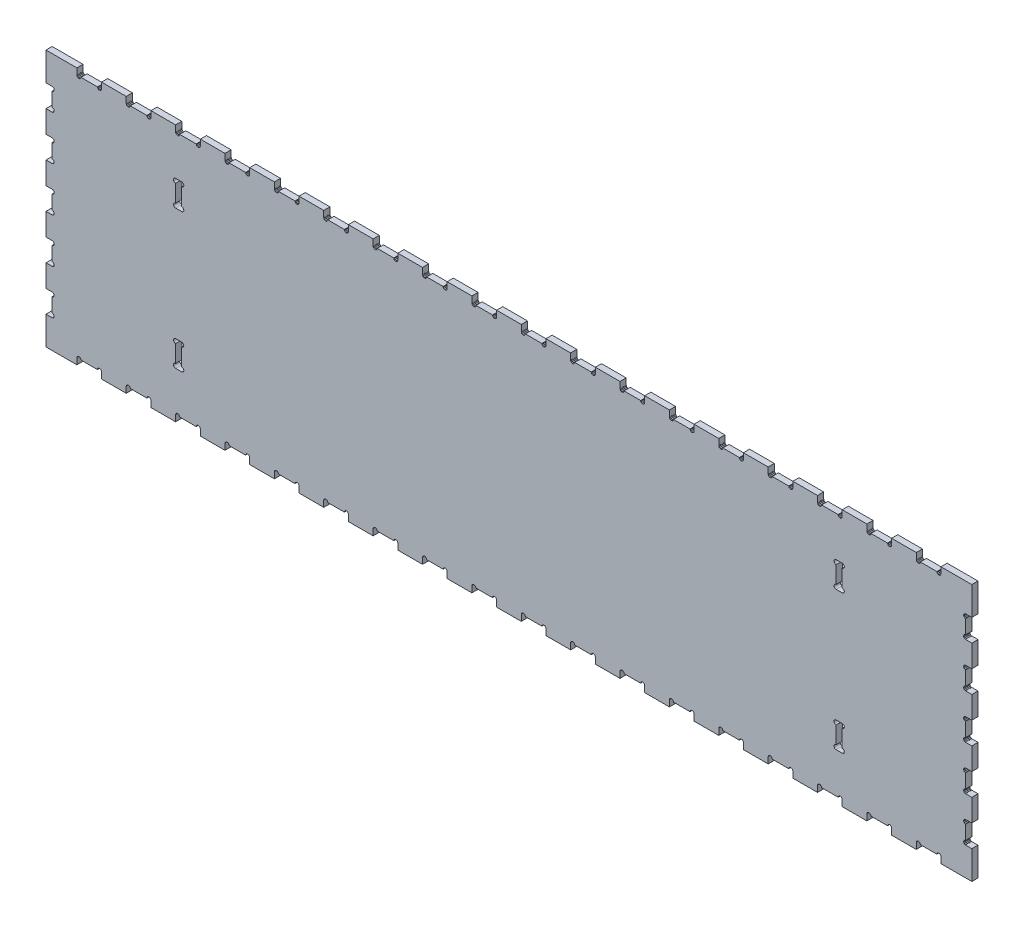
SolidWorks part; units mm, degrees
ref_plane "Спереди" through (0, 0, 0) normal (0, 0, 1) x (1, 0, 0)
ref_plane "Сверху" through (0, 0, 0) normal (0, 1, 0) x (1, 0, 0)
ref_plane "Справа" through (0, 0, 0) normal (1, 0, 0) x (0, 0, -1)
sketch "Sketch1" plane through (0, 0, 0) normal (0, 0, 1) x (1, 0, 0)
  line L0 (1136, -500) -> (1136.09, -500)
  line L1 (1136.09, -500) -> (1136.03, -499.518)
  line L2 (1136.03, -499.518) -> (1136.71, -497.728)
  line L3 (1136.71, -497.728) -> (1138.14, -496.458)
  line L4 (1138.14, -496.458) -> (1140, -496)
  line L5 (1140, -496) -> (1141.86, -496.458)
  line L6 (1141.86, -496.458) -> (1143.29, -497.728)
  line L7 (1143.29, -497.728) -> (1143.97, -499.518)
  line L8 (1143.97, -499.518) -> (1143.91, -500)
  line L9 (1143.91, -500) -> (1176.09, -500)
  line L10 (1176.09, -500) -> (1176.03, -499.518)
  line L11 (1176.03, -499.518) -> (1176.71, -497.728)
  line L12 (1176.71, -497.728) -> (1178.14, -496.458)
  line L13 (1178.14, -496.458) -> (1180, -496)
  line L14 (1180, -496) -> (1181.86, -496.458)
  line L15 (1181.86, -496.458) -> (1183.29, -497.728)
  line L16 (1183.29, -497.728) -> (1183.97, -499.518)
  line L17 (1183.97, -499.518) -> (1183.91, -500)
  line L18 (1183.91, -500) -> (1184, -500)
  line L19 (1184, -500) -> (1184, -512)
  line L20 (1184, -512) -> (1232, -512)
  line L21 (1232, -512) -> (1232, -500)
  line L22 (1232, -500) -> (1232.09, -500)
  line L23 (1232.09, -500) -> (1232.03, -499.518)
  line L24 (1232.03, -499.518) -> (1232.71, -497.728)
  line L25 (1232.71, -497.728) -> (1234.14, -496.458)
  line L26 (1234.14, -496.458) -> (1236, -496)
  line L27 (1236, -496) -> (1237.86, -496.458)
  line L28 (1237.86, -496.458) -> (1239.29, -497.728)
  line L29 (1239.29, -497.728) -> (1239.97, -499.518)
  line L30 (1239.97, -499.518) -> (1239.91, -500)
  line L31 (1239.91, -500) -> (1272.09, -500)
  line L32 (1272.09, -500) -> (1272.03, -499.518)
  line L33 (1272.03, -499.518) -> (1272.71, -497.728)
  line L34 (1272.71, -497.728) -> (1274.14, -496.458)
  line L35 (1274.14, -496.458) -> (1276, -496)
  line L36 (1276, -496) -> (1277.86, -496.458)
  line L37 (1277.86, -496.458) -> (1279.29, -497.728)
  line L38 (1279.29, -497.728) -> (1279.97, -499.518)
  line L39 (1279.97, -499.518) -> (1279.91, -500)
  line L40 (1279.91, -500) -> (1280, -500)
  line L41 (1280, -500) -> (1280, -512)
  line L42 (1280, -512) -> (1328, -512)
  line L43 (1328, -512) -> (1328, -500)
  line L44 (1328, -500) -> (1328.09, -500)
  line L45 (1328.09, -500) -> (1328.03, -499.518)
  line L46 (1328.03, -499.518) -> (1328.71, -497.728)
  line L47 (1328.71, -497.728) -> (1330.14, -496.458)
  line L48 (1330.14, -496.458) -> (1332, -496)
  line L49 (1332, -496) -> (1333.86, -496.458)
  line L50 (1333.86, -496.458) -> (1335.29, -497.728)
  line L51 (1335.29, -497.728) -> (1335.97, -499.518)
  line L52 (1335.97, -499.518) -> (1335.91, -500)
  line L53 (1335.91, -500) -> (1368.09, -500)
  line L54 (1368.09, -500) -> (1368.03, -499.518)
  line L55 (1368.03, -499.518) -> (1368.71, -497.728)
  line L56 (1368.71, -497.728) -> (1370.14, -496.458)
  line L57 (1370.14, -496.458) -> (1372, -496)
  line L58 (1372, -496) -> (1373.86, -496.458)
  line L59 (1373.86, -496.458) -> (1375.29, -497.728)
  line L60 (1375.29, -497.728) -> (1375.97, -499.518)
  line L61 (1375.97, -499.518) -> (1375.91, -500)
  line L62 (1375.91, -500) -> (1376, -500)
  line L63 (1376, -500) -> (1376, -512)
  line L64 (1376, -512) -> (1424, -512)
  line L65 (1424, -512) -> (1424, -500)
  line L66 (1424, -500) -> (1424.09, -500)
  line L67 (1424.09, -500) -> (1424.03, -499.518)
  line L68 (1424.03, -499.518) -> (1424.71, -497.728)
  line L69 (1424.71, -497.728) -> (1426.14, -496.458)
  line L70 (1426.14, -496.458) -> (1428, -496)
  line L71 (1428, -496) -> (1429.86, -496.458)
  line L72 (1429.86, -496.458) -> (1431.29, -497.728)
  line L73 (1431.29, -497.728) -> (1431.97, -499.518)
  line L74 (1431.97, -499.518) -> (1431.91, -500)
  line L75 (1431.91, -500) -> (1464.09, -500)
  line L76 (1464.09, -500) -> (1464.03, -499.518)
  line L77 (1464.03, -499.518) -> (1464.71, -497.728)
  line L78 (1464.71, -497.728) -> (1466.14, -496.458)
  line L79 (1466.14, -496.458) -> (1468, -496)
  line L80 (1468, -496) -> (1469.86, -496.458)
  line L81 (1469.86, -496.458) -> (1471.29, -497.728)
  line L82 (1471.29, -497.728) -> (1471.97, -499.518)
  line L83 (1471.97, -499.518) -> (1471.91, -500)
  line L84 (1471.91, -500) -> (1472, -500)
  line L85 (1472, -500) -> (1472, -512)
  line L86 (1472, -512) -> (1520, -512)
  line L87 (1520, -512) -> (1520, -500)
  line L88 (1520, -500) -> (1520.09, -500)
  line L89 (1520.09, -500) -> (1520.03, -499.518)
  line L90 (1520.03, -499.518) -> (1520.71, -497.728)
  line L91 (1520.71, -497.728) -> (1522.14, -496.458)
  line L92 (1522.14, -496.458) -> (1524, -496)
  line L93 (1524, -496) -> (1525.86, -496.458)
  line L94 (1525.86, -496.458) -> (1527.29, -497.728)
  line L95 (1527.29, -497.728) -> (1527.97, -499.518)
  line L96 (1527.97, -499.518) -> (1527.91, -500)
  line L97 (1527.91, -500) -> (1560.09, -500)
  line L98 (1560.09, -500) -> (1560.03, -499.518)
  line L99 (1560.03, -499.518) -> (1560.71, -497.728)
  line L100 (1560.71, -497.728) -> (1562.14, -496.458)
  line L101 (1562.14, -496.458) -> (1564, -496)
  line L102 (1564, -496) -> (1565.86, -496.458)
  line L103 (1565.86, -496.458) -> (1567.29, -497.728)
  line L104 (1567.29, -497.728) -> (1567.97, -499.518)
  line L105 (1567.97, -499.518) -> (1567.91, -500)
  line L106 (1567.91, -500) -> (1568, -500)
  line L107 (1568, -500) -> (1568, -512)
  line L108 (1568, -512) -> (1616, -512)
  line L109 (1616, -512) -> (1616, -500)
  line L110 (1616, -500) -> (1616.09, -500)
  line L111 (1616.09, -500) -> (1616.03, -499.518)
  line L112 (1616.03, -499.518) -> (1616.71, -497.728)
  line L113 (1616.71, -497.728) -> (1618.14, -496.458)
  line L114 (1618.14, -496.458) -> (1620, -496)
  line L115 (1620, -496) -> (1621.86, -496.458)
  line L116 (1621.86, -496.458) -> (1623.29, -497.728)
  line L117 (1623.29, -497.728) -> (1623.97, -499.518)
  line L118 (1623.97, -499.518) -> (1623.91, -500)
  line L119 (1623.91, -500) -> (1656.09, -500)
  line L120 (1656.09, -500) -> (1656.03, -499.518)
  line L121 (1656.03, -499.518) -> (1656.71, -497.728)
  line L122 (1656.71, -497.728) -> (1658.14, -496.458)
  line L123 (1658.14, -496.458) -> (1660, -496)
  line L124 (1660, -496) -> (1661.86, -496.458)
  line L125 (1661.86, -496.458) -> (1663.29, -497.728)
  line L126 (1663.29, -497.728) -> (1663.97, -499.518)
  line L127 (1663.97, -499.518) -> (1663.91, -500)
  line L128 (1663.91, -500) -> (1664, -500)
  line L129 (1664, -500) -> (1664, -512)
  line L130 (1664, -512) -> (1712, -512)
  line L131 (1712, -512) -> (1712, -500)
  line L132 (1712, -500) -> (1712.09, -500)
  line L133 (1712.09, -500) -> (1712.03, -499.518)
  line L134 (1712.03, -499.518) -> (1712.71, -497.728)
  line L135 (1712.71, -497.728) -> (1714.14, -496.458)
  line L136 (1714.14, -496.458) -> (1716, -496)
  line L137 (1716, -496) -> (1717.86, -496.458)
  line L138 (1717.86, -496.458) -> (1719.29, -497.728)
  line L139 (1719.29, -497.728) -> (1719.97, -499.518)
  line L140 (1719.97, -499.518) -> (1719.91, -500)
  line L141 (1719.91, -500) -> (1752.09, -500)
  line L142 (1752.09, -500) -> (1752.03, -499.518)
  line L143 (1752.03, -499.518) -> (1752.71, -497.728)
  line L144 (1752.71, -497.728) -> (1754.14, -496.458)
  line L145 (1754.14, -496.458) -> (1756, -496)
  line L146 (1756, -496) -> (1757.86, -496.458)
  line L147 (1757.86, -496.458) -> (1759.29, -497.728)
  line L148 (1759.29, -497.728) -> (1759.97, -499.518)
  line L149 (1759.97, -499.518) -> (1759.91, -500)
  line L150 (1759.91, -500) -> (1760, -500)
  line L151 (1760, -500) -> (1760, -512)
  line L152 (1760, -512) -> (1808, -512)
  line L153 (1808, -512) -> (1808, -500)
  line L154 (1808, -500) -> (1808.09, -500)
  line L155 (1808.09, -500) -> (1808.03, -499.518)
  line L156 (1808.03, -499.518) -> (1808.71, -497.728)
  line L157 (1808.71, -497.728) -> (1810.14, -496.458)
  line L158 (1810.14, -496.458) -> (1812, -496)
  line L159 (1812, -496) -> (1813.86, -496.458)
  line L160 (1813.86, -496.458) -> (1815.29, -497.728)
  line L161 (1815.29, -497.728) -> (1815.97, -499.518)
  line L162 (1815.97, -499.518) -> (1815.91, -500)
  line L163 (1815.91, -500) -> (1848.09, -500)
  line L164 (1848.09, -500) -> (1848.03, -499.518)
  line L165 (1848.03, -499.518) -> (1848.71, -497.728)
  line L166 (1848.71, -497.728) -> (1850.14, -496.458)
  line L167 (1850.14, -496.458) -> (1852, -496)
  line L168 (1852, -496) -> (1853.86, -496.458)
  line L169 (1853.86, -496.458) -> (1855.29, -497.728)
  line L170 (1855.29, -497.728) -> (1855.97, -499.518)
  line L171 (1855.97, -499.518) -> (1855.91, -500)
  line L172 (1855.91, -500) -> (1856, -500)
  line L173 (1856, -500) -> (1856, -512)
  line L174 (1856, -512) -> (1904, -512)
  line L175 (1904, -512) -> (1904, -500)
  line L176 (1904, -500) -> (1904.09, -500)
  line L177 (1904.09, -500) -> (1904.03, -499.518)
  line L178 (1904.03, -499.518) -> (1904.71, -497.728)
  line L179 (1904.71, -497.728) -> (1906.14, -496.458)
  line L180 (1906.14, -496.458) -> (1908, -496)
  line L181 (1908, -496) -> (1909.86, -496.458)
  line L182 (1909.86, -496.458) -> (1911.29, -497.728)
  line L183 (1911.29, -497.728) -> (1911.97, -499.518)
  line L184 (1911.97, -499.518) -> (1911.91, -500)
  line L185 (1911.91, -500) -> (1944.09, -500)
  line L186 (1944.09, -500) -> (1944.03, -499.518)
  line L187 (1944.03, -499.518) -> (1944.71, -497.728)
  line L188 (1944.71, -497.728) -> (1946.14, -496.458)
  line L189 (1946.14, -496.458) -> (1948, -496)
  line L190 (1948, -496) -> (1949.86, -496.458)
  line L191 (1949.86, -496.458) -> (1951.29, -497.728)
  line L192 (1951.29, -497.728) -> (1951.97, -499.518)
  line L193 (1951.97, -499.518) -> (1951.91, -500)
  line L194 (1951.91, -500) -> (1952, -500)
  line L195 (1952, -500) -> (1952, -512)
  line L196 (1952, -512) -> (2012, -512)
  line L197 (2012, -512) -> (2012, -456.727)
  line L198 (2012, -456.727) -> (2000, -456.727)
  line L199 (2000, -456.727) -> (2000, -456.611)
  line L200 (2000, -456.611) -> (1999.04, -456.611)
  line L201 (1999.04, -456.611) -> (1997.35, -455.721)
  line L202 (1997.35, -455.721) -> (1996.26, -454.146)
  line L203 (1996.26, -454.146) -> (1996.03, -452.245)
  line L204 (1996.03, -452.245) -> (1996.71, -450.455)
  line L205 (1996.71, -450.455) -> (1998.14, -449.185)
  line L206 (1998.14, -449.185) -> (2000, -448.727)
  line L207 (2000, -448.727) -> (2000, -421.338)
  line L208 (2000, -421.338) -> (1999.04, -421.338)
  line L209 (1999.04, -421.338) -> (1997.35, -420.449)
  line L210 (1997.35, -420.449) -> (1996.26, -418.873)
  line L211 (1996.26, -418.873) -> (1996.03, -416.972)
  line L212 (1996.03, -416.972) -> (1996.71, -415.182)
  line L213 (1996.71, -415.182) -> (1998.14, -413.913)
  line L214 (1998.14, -413.913) -> (2000, -413.455)
  line L215 (2000, -413.455) -> (2012, -413.455)
  line L216 (2012, -413.455) -> (2012, -370.182)
  line L217 (2012, -370.182) -> (2000, -370.182)
  line L218 (2000, -370.182) -> (2000, -370.066)
  line L219 (2000, -370.066) -> (1999.04, -370.066)
  line L220 (1999.04, -370.066) -> (1997.35, -369.176)
  line L221 (1997.35, -369.176) -> (1996.26, -367.6)
  line L222 (1996.26, -367.6) -> (1996.03, -365.7)
  line L223 (1996.03, -365.7) -> (1996.71, -363.91)
  line L224 (1996.71, -363.91) -> (1998.14, -362.64)
  line L225 (1998.14, -362.64) -> (2000, -362.182)
  line L226 (2000, -362.182) -> (2000, -334.793)
  line L227 (2000, -334.793) -> (1999.04, -334.793)
  line L228 (1999.04, -334.793) -> (1997.35, -333.903)
  line L229 (1997.35, -333.903) -> (1996.26, -332.327)
  line L230 (1996.26, -332.327) -> (1996.03, -330.427)
  line L231 (1996.03, -330.427) -> (1996.71, -328.637)
  line L232 (1996.71, -328.637) -> (1998.14, -327.367)
  line L233 (1998.14, -327.367) -> (2000, -326.909)
  line L234 (2000, -326.909) -> (2012, -326.909)
  line L235 (2012, -326.909) -> (2012, -283.636)
  line L236 (2012, -283.636) -> (2000, -283.636)
  line L237 (2000, -283.636) -> (2000, -283.52)
  line L238 (2000, -283.52) -> (1999.04, -283.52)
  line L239 (1999.04, -283.52) -> (1997.35, -282.63)
  line L240 (1997.35, -282.63) -> (1996.26, -281.055)
  line L241 (1996.26, -281.055) -> (1996.03, -279.154)
  line L242 (1996.03, -279.154) -> (1996.71, -277.364)
  line L243 (1996.71, -277.364) -> (1998.14, -276.095)
  line L244 (1998.14, -276.095) -> (2000, -275.636)
  line L245 (2000, -275.636) -> (2000, -248.247)
  line L246 (2000, -248.247) -> (1999.04, -248.247)
  line L247 (1999.04, -248.247) -> (1997.35, -247.358)
  line L248 (1997.35, -247.358) -> (1996.26, -245.782)
  line L249 (1996.26, -245.782) -> (1996.03, -243.882)
  line L250 (1996.03, -243.882) -> (1996.71, -242.091)
  line L251 (1996.71, -242.091) -> (1998.14, -240.822)
  line L252 (1998.14, -240.822) -> (2000, -240.364)
  line L253 (2000, -240.364) -> (2012, -240.364)
  line L254 (2012, -240.364) -> (2012, -197.091)
  line L255 (2012, -197.091) -> (2000, -197.091)
  line L256 (2000, -197.091) -> (2000, -196.975)
  line L257 (2000, -196.975) -> (1999.04, -196.975)
  line L258 (1999.04, -196.975) -> (1997.35, -196.085)
  line L259 (1997.35, -196.085) -> (1996.26, -194.509)
  line L260 (1996.26, -194.509) -> (1996.03, -192.609)
  line L261 (1996.03, -192.609) -> (1996.71, -190.819)
  line L262 (1996.71, -190.819) -> (1998.14, -189.549)
  line L263 (1998.14, -189.549) -> (2000, -189.091)
  line L264 (2000, -189.091) -> (2000, -161.702)
  line L265 (2000, -161.702) -> (1999.04, -161.702)
  line L266 (1999.04, -161.702) -> (1997.35, -160.812)
  line L267 (1997.35, -160.812) -> (1996.26, -159.237)
  line L268 (1996.26, -159.237) -> (1996.03, -157.336)
  line L269 (1996.03, -157.336) -> (1996.71, -155.546)
  line L270 (1996.71, -155.546) -> (1998.14, -154.276)
  line L271 (1998.14, -154.276) -> (2000, -153.818)
  line L272 (2000, -153.818) -> (2012, -153.818)
  line L273 (2012, -153.818) -> (2012, -110.545)
  line L274 (2012, -110.545) -> (2000, -110.545)
  line L275 (2000, -110.545) -> (2000, -110.429)
  line L276 (2000, -110.429) -> (1999.04, -110.429)
  line L277 (1999.04, -110.429) -> (1997.35, -109.54)
  line L278 (1997.35, -109.54) -> (1996.26, -107.964)
  line L279 (1996.26, -107.964) -> (1996.03, -106.063)
  line L280 (1996.03, -106.063) -> (1996.71, -104.273)
  line L281 (1996.71, -104.273) -> (1998.14, -103.004)
  line L282 (1998.14, -103.004) -> (2000, -102.545)
  line L283 (2000, -102.545) -> (2000, -75.1565)
  line L284 (2000, -75.1565) -> (1999.04, -75.1565)
  line L285 (1999.04, -75.1565) -> (1997.35, -74.2668)
  line L286 (1997.35, -74.2668) -> (1996.26, -72.6912)
  line L287 (1996.26, -72.6912) -> (1996.03, -70.7906)
  line L288 (1996.03, -70.7906) -> (1996.71, -69.0005)
  line L289 (1996.71, -69.0005) -> (1998.14, -67.7309)
  line L290 (1998.14, -67.7309) -> (2000, -67.2728)
  line L291 (2000, -67.2728) -> (2012, -67.2728)
  line L292 (2012, -67.2728) -> (2012, -12)
  line L293 (2012, -12) -> (1952, -12)
  line L294 (1952, -12) -> (1952, -24)
  line L295 (1952, -24) -> (1951.91, -24)
  line L296 (1951.91, -24) -> (1951.74, -25.4184)
  line L297 (1951.74, -25.4184) -> (1950.65, -26.9941)
  line L298 (1950.65, -26.9941) -> (1948.96, -27.8838)
  line L299 (1948.96, -27.8838) -> (1947.04, -27.8838)
  line L300 (1947.04, -27.8838) -> (1945.35, -26.9941)
  line L301 (1945.35, -26.9941) -> (1944.26, -25.4184)
  line L302 (1944.26, -25.4184) -> (1944.09, -24)
  line L303 (1944.09, -24) -> (1911.91, -24)
  line L304 (1911.91, -24) -> (1911.74, -25.4184)
  line L305 (1911.74, -25.4184) -> (1910.65, -26.9941)
  line L306 (1910.65, -26.9941) -> (1908.96, -27.8838)
  line L307 (1908.96, -27.8838) -> (1907.04, -27.8838)
  line L308 (1907.04, -27.8838) -> (1905.35, -26.9941)
  line L309 (1905.35, -26.9941) -> (1904.26, -25.4184)
  line L310 (1904.26, -25.4184) -> (1904.09, -24)
  line L311 (1904.09, -24) -> (1904, -24)
  line L312 (1904, -24) -> (1904, -12)
  line L313 (1904, -12) -> (1856, -12)
  line L314 (1856, -12) -> (1856, -24)
  line L315 (1856, -24) -> (1855.91, -24)
  line L316 (1855.91, -24) -> (1855.74, -25.4184)
  line L317 (1855.74, -25.4184) -> (1854.65, -26.9941)
  line L318 (1854.65, -26.9941) -> (1852.96, -27.8838)
  line L319 (1852.96, -27.8838) -> (1851.04, -27.8838)
  line L320 (1851.04, -27.8838) -> (1849.35, -26.9941)
  line L321 (1849.35, -26.9941) -> (1848.26, -25.4184)
  line L322 (1848.26, -25.4184) -> (1848.09, -24)
  line L323 (1848.09, -24) -> (1815.91, -24)
  line L324 (1815.91, -24) -> (1815.74, -25.4184)
  line L325 (1815.74, -25.4184) -> (1814.65, -26.9941)
  line L326 (1814.65, -26.9941) -> (1812.96, -27.8838)
  line L327 (1812.96, -27.8838) -> (1811.04, -27.8838)
  line L328 (1811.04, -27.8838) -> (1809.35, -26.9941)
  line L329 (1809.35, -26.9941) -> (1808.26, -25.4184)
  line L330 (1808.26, -25.4184) -> (1808.09, -24)
  line L331 (1808.09, -24) -> (1808, -24)
  line L332 (1808, -24) -> (1808, -12)
  line L333 (1808, -12) -> (1760, -12)
  line L334 (1760, -12) -> (1760, -24)
  line L335 (1760, -24) -> (1759.91, -24)
  line L336 (1759.91, -24) -> (1759.74, -25.4184)
  line L337 (1759.74, -25.4184) -> (1758.65, -26.9941)
  line L338 (1758.65, -26.9941) -> (1756.96, -27.8838)
  line L339 (1756.96, -27.8838) -> (1755.04, -27.8838)
  line L340 (1755.04, -27.8838) -> (1753.35, -26.9941)
  line L341 (1753.35, -26.9941) -> (1752.26, -25.4184)
  line L342 (1752.26, -25.4184) -> (1752.09, -24)
  line L343 (1752.09, -24) -> (1719.91, -24)
  line L344 (1719.91, -24) -> (1719.74, -25.4184)
  line L345 (1719.74, -25.4184) -> (1718.65, -26.9941)
  line L346 (1718.65, -26.9941) -> (1716.96, -27.8838)
  line L347 (1716.96, -27.8838) -> (1715.04, -27.8838)
  line L348 (1715.04, -27.8838) -> (1713.35, -26.9941)
  line L349 (1713.35, -26.9941) -> (1712.26, -25.4184)
  line L350 (1712.26, -25.4184) -> (1712.09, -24)
  line L351 (1712.09, -24) -> (1712, -24)
  line L352 (1712, -24) -> (1712, -12)
  line L353 (1712, -12) -> (1664, -12)
  line L354 (1664, -12) -> (1664, -24)
  line L355 (1664, -24) -> (1663.91, -24)
  line L356 (1663.91, -24) -> (1663.74, -25.4184)
  line L357 (1663.74, -25.4184) -> (1662.65, -26.9941)
  line L358 (1662.65, -26.9941) -> (1660.96, -27.8838)
  line L359 (1660.96, -27.8838) -> (1659.04, -27.8838)
  line L360 (1659.04, -27.8838) -> (1657.35, -26.9941)
  line L361 (1657.35, -26.9941) -> (1656.26, -25.4184)
  line L362 (1656.26, -25.4184) -> (1656.09, -24)
  line L363 (1656.09, -24) -> (1623.91, -24)
  line L364 (1623.91, -24) -> (1623.74, -25.4184)
  line L365 (1623.74, -25.4184) -> (1622.65, -26.9941)
  line L366 (1622.65, -26.9941) -> (1620.96, -27.8838)
  line L367 (1620.96, -27.8838) -> (1619.04, -27.8838)
  line L368 (1619.04, -27.8838) -> (1617.35, -26.9941)
  line L369 (1617.35, -26.9941) -> (1616.26, -25.4184)
  line L370 (1616.26, -25.4184) -> (1616.09, -24)
  line L371 (1616.09, -24) -> (1616, -24)
  line L372 (1616, -24) -> (1616, -12)
  line L373 (1616, -12) -> (1568, -12)
  line L374 (1568, -12) -> (1568, -24)
  line L375 (1568, -24) -> (1567.91, -24)
  line L376 (1567.91, -24) -> (1567.74, -25.4184)
  line L377 (1567.74, -25.4184) -> (1566.65, -26.9941)
  line L378 (1566.65, -26.9941) -> (1564.96, -27.8838)
  line L379 (1564.96, -27.8838) -> (1563.04, -27.8838)
  line L380 (1563.04, -27.8838) -> (1561.35, -26.9941)
  line L381 (1561.35, -26.9941) -> (1560.26, -25.4184)
  line L382 (1560.26, -25.4184) -> (1560.09, -24)
  line L383 (1560.09, -24) -> (1527.91, -24)
  line L384 (1527.91, -24) -> (1527.74, -25.4184)
  line L385 (1527.74, -25.4184) -> (1526.65, -26.9941)
  line L386 (1526.65, -26.9941) -> (1524.96, -27.8838)
  line L387 (1524.96, -27.8838) -> (1523.04, -27.8838)
  line L388 (1523.04, -27.8838) -> (1521.35, -26.9941)
  line L389 (1521.35, -26.9941) -> (1520.26, -25.4184)
  line L390 (1520.26, -25.4184) -> (1520.09, -24)
  line L391 (1520.09, -24) -> (1520, -24)
  line L392 (1520, -24) -> (1520, -12)
  line L393 (1520, -12) -> (1472, -12)
  line L394 (1472, -12) -> (1472, -24)
  line L395 (1472, -24) -> (1471.91, -24)
  line L396 (1471.91, -24) -> (1471.74, -25.4184)
  line L397 (1471.74, -25.4184) -> (1470.65, -26.9941)
  line L398 (1470.65, -26.9941) -> (1468.96, -27.8838)
  line L399 (1468.96, -27.8838) -> (1467.04, -27.8838)
  line L400 (1467.04, -27.8838) -> (1465.35, -26.9941)
  line L401 (1465.35, -26.9941) -> (1464.26, -25.4184)
  line L402 (1464.26, -25.4184) -> (1464.09, -24)
  line L403 (1464.09, -24) -> (1431.91, -24)
  line L404 (1431.91, -24) -> (1431.74, -25.4184)
  line L405 (1431.74, -25.4184) -> (1430.65, -26.9941)
  line L406 (1430.65, -26.9941) -> (1428.96, -27.8838)
  line L407 (1428.96, -27.8838) -> (1427.04, -27.8838)
  line L408 (1427.04, -27.8838) -> (1425.35, -26.9941)
  line L409 (1425.35, -26.9941) -> (1424.26, -25.4184)
  line L410 (1424.26, -25.4184) -> (1424.09, -24)
  line L411 (1424.09, -24) -> (1424, -24)
  line L412 (1424, -24) -> (1424, -12)
  line L413 (1424, -12) -> (1376, -12)
  line L414 (1376, -12) -> (1376, -24)
  line L415 (1376, -24) -> (1375.91, -24)
  line L416 (1375.91, -24) -> (1375.74, -25.4184)
  line L417 (1375.74, -25.4184) -> (1374.65, -26.9941)
  line L418 (1374.65, -26.9941) -> (1372.96, -27.8838)
  line L419 (1372.96, -27.8838) -> (1371.04, -27.8838)
  line L420 (1371.04, -27.8838) -> (1369.35, -26.9941)
  line L421 (1369.35, -26.9941) -> (1368.26, -25.4184)
  line L422 (1368.26, -25.4184) -> (1368.09, -24)
  line L423 (1368.09, -24) -> (1335.91, -24)
  line L424 (1335.91, -24) -> (1335.74, -25.4184)
  line L425 (1335.74, -25.4184) -> (1334.65, -26.9941)
  line L426 (1334.65, -26.9941) -> (1332.96, -27.8838)
  line L427 (1332.96, -27.8838) -> (1331.04, -27.8838)
  line L428 (1331.04, -27.8838) -> (1329.35, -26.9941)
  line L429 (1329.35, -26.9941) -> (1328.26, -25.4184)
  line L430 (1328.26, -25.4184) -> (1328.09, -24)
  line L431 (1328.09, -24) -> (1328, -24)
  line L432 (1328, -24) -> (1328, -12)
  line L433 (1328, -12) -> (1280, -12)
  line L434 (1280, -12) -> (1280, -24)
  line L435 (1280, -24) -> (1279.91, -24)
  line L436 (1279.91, -24) -> (1279.74, -25.4184)
  line L437 (1279.74, -25.4184) -> (1278.65, -26.9941)
  line L438 (1278.65, -26.9941) -> (1276.96, -27.8838)
  line L439 (1276.96, -27.8838) -> (1275.04, -27.8838)
  line L440 (1275.04, -27.8838) -> (1273.35, -26.9941)
  line L441 (1273.35, -26.9941) -> (1272.26, -25.4184)
  line L442 (1272.26, -25.4184) -> (1272.09, -24)
  line L443 (1272.09, -24) -> (1239.91, -24)
  line L444 (1239.91, -24) -> (1239.74, -25.4184)
  line L445 (1239.74, -25.4184) -> (1238.65, -26.9941)
  line L446 (1238.65, -26.9941) -> (1236.96, -27.8838)
  line L447 (1236.96, -27.8838) -> (1235.04, -27.8838)
  line L448 (1235.04, -27.8838) -> (1233.35, -26.9941)
  line L449 (1233.35, -26.9941) -> (1232.26, -25.4184)
  line L450 (1232.26, -25.4184) -> (1232.09, -24)
  line L451 (1232.09, -24) -> (1232, -24)
  line L452 (1232, -24) -> (1232, -12)
  line L453 (1232, -12) -> (1184, -12)
  line L454 (1184, -12) -> (1184, -24)
  line L455 (1184, -24) -> (1183.91, -24)
  line L456 (1183.91, -24) -> (1183.74, -25.4184)
  line L457 (1183.74, -25.4184) -> (1182.65, -26.9941)
  line L458 (1182.65, -26.9941) -> (1180.96, -27.8838)
  line L459 (1180.96, -27.8838) -> (1179.04, -27.8838)
  line L460 (1179.04, -27.8838) -> (1177.35, -26.9941)
  line L461 (1177.35, -26.9941) -> (1176.26, -25.4184)
  line L462 (1176.26, -25.4184) -> (1176.09, -24)
  line L463 (1176.09, -24) -> (1143.91, -24)
  line L464 (1143.91, -24) -> (1143.74, -25.4184)
  line L465 (1143.74, -25.4184) -> (1142.65, -26.994)
  line L466 (1142.65, -26.994) -> (1140.96, -27.8838)
  line L467 (1140.96, -27.8838) -> (1139.04, -27.8838)
  line L468 (1139.04, -27.8838) -> (1137.35, -26.994)
  line L469 (1137.35, -26.994) -> (1136.26, -25.4184)
  line L470 (1136.26, -25.4184) -> (1136.09, -24)
  line L471 (1136.09, -24) -> (1136, -24)
  line L472 (1136, -24) -> (1136, -12)
  line L473 (1136, -12) -> (1088, -12)
  line L474 (1088, -12) -> (1088, -24)
  line L475 (1088, -24) -> (1087.91, -24)
  line L476 (1087.91, -24) -> (1087.74, -25.4184)
  line L477 (1087.74, -25.4184) -> (1086.65, -26.994)
  line L478 (1086.65, -26.994) -> (1084.96, -27.8838)
  line L479 (1084.96, -27.8838) -> (1083.04, -27.8838)
  line L480 (1083.04, -27.8838) -> (1081.35, -26.994)
  line L481 (1081.35, -26.994) -> (1080.26, -25.4184)
  line L482 (1080.26, -25.4184) -> (1080.09, -24)
  line L483 (1080.09, -24) -> (1047.91, -24)
  line L484 (1047.91, -24) -> (1047.74, -25.4184)
  line L485 (1047.74, -25.4184) -> (1046.65, -26.994)
  line L486 (1046.65, -26.994) -> (1044.96, -27.8838)
  line L487 (1044.96, -27.8838) -> (1043.04, -27.8838)
  line L488 (1043.04, -27.8838) -> (1041.35, -26.994)
  line L489 (1041.35, -26.994) -> (1040.26, -25.4184)
  line L490 (1040.26, -25.4184) -> (1040.09, -24)
  line L491 (1040.09, -24) -> (1040, -24)
  line L492 (1040, -24) -> (1040, -12)
  line L493 (1040, -12) -> (992, -12)
  line L494 (992, -12) -> (992, -24)
  line L495 (992, -24) -> (991.912, -24)
  line L496 (991.912, -24) -> (991.74, -25.4184)
  line L497 (991.74, -25.4184) -> (990.652, -26.994)
  line L498 (990.652, -26.994) -> (988.957, -27.8838)
  line L499 (988.957, -27.8838) -> (987.043, -27.8838)
  line L500 (987.043, -27.8838) -> (985.348, -26.994)
  line L501 (985.348, -26.994) -> (984.26, -25.4184)
  line L502 (984.26, -25.4184) -> (984.088, -24)
  line L503 (984.088, -24) -> (951.912, -24)
  line L504 (951.912, -24) -> (951.74, -25.4184)
  line L505 (951.74, -25.4184) -> (950.652, -26.994)
  line L506 (950.652, -26.994) -> (948.957, -27.8838)
  line L507 (948.957, -27.8838) -> (947.043, -27.8838)
  line L508 (947.043, -27.8838) -> (945.348, -26.994)
  line L509 (945.348, -26.994) -> (944.26, -25.4184)
  line L510 (944.26, -25.4184) -> (944.088, -24)
  line L511 (944.088, -24) -> (944, -24)
  line L512 (944, -24) -> (944, -12)
  line L513 (944, -12) -> (896, -12)
  line L514 (896, -12) -> (896, -24)
  line L515 (896, -24) -> (895.912, -24)
  line L516 (895.912, -24) -> (895.74, -25.4184)
  line L517 (895.74, -25.4184) -> (894.652, -26.994)
  line L518 (894.652, -26.994) -> (892.957, -27.8838)
  line L519 (892.957, -27.8838) -> (891.043, -27.8838)
  line L520 (891.043, -27.8838) -> (889.348, -26.994)
  line L521 (889.348, -26.994) -> (888.26, -25.4184)
  line L522 (888.26, -25.4184) -> (888.088, -24)
  line L523 (888.088, -24) -> (855.912, -24)
  line L524 (855.912, -24) -> (855.74, -25.4184)
  line L525 (855.74, -25.4184) -> (854.652, -26.994)
  line L526 (854.652, -26.994) -> (852.957, -27.8838)
  line L527 (852.957, -27.8838) -> (851.043, -27.8838)
  line L528 (851.043, -27.8838) -> (849.348, -26.994)
  line L529 (849.348, -26.994) -> (848.26, -25.4184)
  line L530 (848.26, -25.4184) -> (848.088, -24)
  line L531 (848.088, -24) -> (848, -24)
  line L532 (848, -24) -> (848, -12)
  line L533 (848, -12) -> (800, -12)
  line L534 (800, -12) -> (800, -24)
  line L535 (800, -24) -> (799.912, -24)
  line L536 (799.912, -24) -> (799.74, -25.4184)
  line L537 (799.74, -25.4184) -> (798.652, -26.994)
  line L538 (798.652, -26.994) -> (796.957, -27.8838)
  line L539 (796.957, -27.8838) -> (795.043, -27.8838)
  line L540 (795.043, -27.8838) -> (793.348, -26.994)
  line L541 (793.348, -26.994) -> (792.26, -25.4184)
  line L542 (792.26, -25.4184) -> (792.088, -24)
  line L543 (792.088, -24) -> (759.912, -24)
  line L544 (759.912, -24) -> (759.74, -25.4184)
  line L545 (759.74, -25.4184) -> (758.652, -26.994)
  line L546 (758.652, -26.994) -> (756.957, -27.8838)
  line L547 (756.957, -27.8838) -> (755.043, -27.8838)
  line L548 (755.043, -27.8838) -> (753.348, -26.994)
  line L549 (753.348, -26.994) -> (752.26, -25.4184)
  line L550 (752.26, -25.4184) -> (752.088, -24)
  line L551 (752.088, -24) -> (752, -24)
  line L552 (752, -24) -> (752, -12)
  line L553 (752, -12) -> (704, -12)
  line L554 (704, -12) -> (704, -24)
  line L555 (704, -24) -> (703.912, -24)
  line L556 (703.912, -24) -> (703.74, -25.4184)
  line L557 (703.74, -25.4184) -> (702.652, -26.994)
  line L558 (702.652, -26.994) -> (700.957, -27.8838)
  line L559 (700.957, -27.8838) -> (699.043, -27.8838)
  line L560 (699.043, -27.8838) -> (697.348, -26.994)
  line L561 (697.348, -26.994) -> (696.26, -25.4184)
  line L562 (696.26, -25.4184) -> (696.088, -24)
  line L563 (696.088, -24) -> (663.912, -24)
  line L564 (663.912, -24) -> (663.74, -25.4184)
  line L565 (663.74, -25.4184) -> (662.652, -26.994)
  line L566 (662.652, -26.994) -> (660.957, -27.8838)
  line L567 (660.957, -27.8838) -> (659.043, -27.8838)
  line L568 (659.043, -27.8838) -> (657.348, -26.994)
  line L569 (657.348, -26.994) -> (656.26, -25.4184)
  line L570 (656.26, -25.4184) -> (656.088, -24)
  line L571 (656.088, -24) -> (656, -24)
  line L572 (656, -24) -> (656, -12)
  line L573 (656, -12) -> (608, -12)
  line L574 (608, -12) -> (608, -24)
  line L575 (608, -24) -> (607.912, -24)
  line L576 (607.912, -24) -> (607.74, -25.4184)
  line L577 (607.74, -25.4184) -> (606.652, -26.994)
  line L578 (606.652, -26.994) -> (604.957, -27.8838)
  line L579 (604.957, -27.8838) -> (603.043, -27.8838)
  line L580 (603.043, -27.8838) -> (601.348, -26.994)
  line L581 (601.348, -26.994) -> (600.26, -25.4184)
  line L582 (600.26, -25.4184) -> (600.088, -24)
  line L583 (600.088, -24) -> (567.912, -24)
  line L584 (567.912, -24) -> (567.74, -25.4184)
  line L585 (567.74, -25.4184) -> (566.652, -26.994)
  line L586 (566.652, -26.994) -> (564.957, -27.8838)
  line L587 (564.957, -27.8838) -> (563.043, -27.8838)
  line L588 (563.043, -27.8838) -> (561.348, -26.994)
  line L589 (561.348, -26.994) -> (560.26, -25.4184)
  line L590 (560.26, -25.4184) -> (560.088, -24)
  line L591 (560.088, -24) -> (560, -24)
  line L592 (560, -24) -> (560, -12)
  line L593 (560, -12) -> (512, -12)
  line L594 (512, -12) -> (512, -24)
  line L595 (512, -24) -> (511.912, -24)
  line L596 (511.912, -24) -> (511.74, -25.4184)
  line L597 (511.74, -25.4184) -> (510.652, -26.994)
  line L598 (510.652, -26.994) -> (508.957, -27.8838)
  line L599 (508.957, -27.8838) -> (507.043, -27.8838)
  line L600 (507.043, -27.8838) -> (505.348, -26.994)
  line L601 (505.348, -26.994) -> (504.26, -25.4184)
  line L602 (504.26, -25.4184) -> (504.088, -24)
  line L603 (504.088, -24) -> (471.912, -24)
  line L604 (471.912, -24) -> (471.74, -25.4184)
  line L605 (471.74, -25.4184) -> (470.652, -26.994)
  line L606 (470.652, -26.994) -> (468.957, -27.8838)
  line L607 (468.957, -27.8838) -> (467.043, -27.8838)
  line L608 (467.043, -27.8838) -> (465.348, -26.994)
  line L609 (465.348, -26.994) -> (464.26, -25.4184)
  line L610 (464.26, -25.4184) -> (464.088, -24)
  line L611 (464.088, -24) -> (464, -24)
  line L612 (464, -24) -> (464, -12)
  line L613 (464, -12) -> (416, -12)
  line L614 (416, -12) -> (416, -24)
  line L615 (416, -24) -> (415.912, -24)
  line L616 (415.912, -24) -> (415.74, -25.4184)
  line L617 (415.74, -25.4184) -> (414.652, -26.994)
  line L618 (414.652, -26.994) -> (412.957, -27.8838)
  line L619 (412.957, -27.8838) -> (411.043, -27.8838)
  line L620 (411.043, -27.8838) -> (409.348, -26.994)
  line L621 (409.348, -26.994) -> (408.26, -25.4184)
  line L622 (408.26, -25.4184) -> (408.088, -24)
  line L623 (408.088, -24) -> (375.912, -24)
  line L624 (375.912, -24) -> (375.74, -25.4184)
  line L625 (375.74, -25.4184) -> (374.652, -26.994)
  line L626 (374.652, -26.994) -> (372.957, -27.8838)
  line L627 (372.957, -27.8838) -> (371.043, -27.8838)
  line L628 (371.043, -27.8838) -> (369.348, -26.994)
  line L629 (369.348, -26.994) -> (368.26, -25.4184)
  line L630 (368.26, -25.4184) -> (368.088, -24)
  line L631 (368.088, -24) -> (368, -24)
  line L632 (368, -24) -> (368, -12)
  line L633 (368, -12) -> (320, -12)
  line L634 (320, -12) -> (320, -24)
  line L635 (320, -24) -> (319.912, -24)
  line L636 (319.912, -24) -> (319.74, -25.4184)
  line L637 (319.74, -25.4184) -> (318.652, -26.994)
  line L638 (318.652, -26.994) -> (316.957, -27.8838)
  line L639 (316.957, -27.8838) -> (315.043, -27.8838)
  line L640 (315.043, -27.8838) -> (313.348, -26.994)
  line L641 (313.348, -26.994) -> (312.26, -25.4184)
  line L642 (312.26, -25.4184) -> (312.088, -24)
  line L643 (312.088, -24) -> (279.912, -24)
  line L644 (279.912, -24) -> (279.74, -25.4184)
  line L645 (279.74, -25.4184) -> (278.652, -26.994)
  line L646 (278.652, -26.994) -> (276.957, -27.8838)
  line L647 (276.957, -27.8838) -> (275.043, -27.8838)
  line L648 (275.043, -27.8838) -> (273.348, -26.994)
  line L649 (273.348, -26.994) -> (272.26, -25.4184)
  line L650 (272.26, -25.4184) -> (272.088, -24)
  line L651 (272.088, -24) -> (272, -24)
  line L652 (272, -24) -> (272, -12)
  line L653 (272, -12) -> (212, -12)
  line L654 (212, -12) -> (212, -67.2727)
  line L655 (212, -67.2727) -> (224, -67.2727)
  line L656 (224, -67.2727) -> (225.859, -67.7309)
  line L657 (225.859, -67.7309) -> (227.292, -69.0005)
  line L658 (227.292, -69.0005) -> (227.971, -70.7906)
  line L659 (227.971, -70.7906) -> (227.74, -72.6911)
  line L660 (227.74, -72.6911) -> (226.652, -74.2668)
  line L661 (226.652, -74.2668) -> (224.957, -75.1565)
  line L662 (224.957, -75.1565) -> (224, -75.1565)
  line L663 (224, -75.1565) -> (224, -102.545)
  line L664 (224, -102.545) -> (225.859, -103.004)
  line L665 (225.859, -103.004) -> (227.292, -104.273)
  line L666 (227.292, -104.273) -> (227.971, -106.063)
  line L667 (227.971, -106.063) -> (227.74, -107.964)
  line L668 (227.74, -107.964) -> (226.652, -109.54)
  line L669 (226.652, -109.54) -> (224.957, -110.429)
  line L670 (224.957, -110.429) -> (224, -110.429)
  line L671 (224, -110.429) -> (224, -110.545)
  line L672 (224, -110.545) -> (212, -110.545)
  line L673 (212, -110.545) -> (212, -153.818)
  line L674 (212, -153.818) -> (224, -153.818)
  line L675 (224, -153.818) -> (225.859, -154.276)
  line L676 (225.859, -154.276) -> (227.292, -155.546)
  line L677 (227.292, -155.546) -> (227.971, -157.336)
  line L678 (227.971, -157.336) -> (227.74, -159.237)
  line L679 (227.74, -159.237) -> (226.652, -160.812)
  line L680 (226.652, -160.812) -> (224.957, -161.702)
  line L681 (224.957, -161.702) -> (224, -161.702)
  line L682 (224, -161.702) -> (224, -189.091)
  line L683 (224, -189.091) -> (225.859, -189.549)
  line L684 (225.859, -189.549) -> (227.292, -190.819)
  line L685 (227.292, -190.819) -> (227.971, -192.609)
  line L686 (227.971, -192.609) -> (227.74, -194.509)
  line L687 (227.74, -194.509) -> (226.652, -196.085)
  line L688 (226.652, -196.085) -> (224.957, -196.975)
  line L689 (224.957, -196.975) -> (224, -196.975)
  line L690 (224, -196.975) -> (224, -197.091)
  line L691 (224, -197.091) -> (212, -197.091)
  line L692 (212, -197.091) -> (212, -240.364)
  line L693 (212, -240.364) -> (224, -240.364)
  line L694 (224, -240.364) -> (225.859, -240.822)
  line L695 (225.859, -240.822) -> (227.292, -242.091)
  line L696 (227.292, -242.091) -> (227.971, -243.882)
  line L697 (227.971, -243.882) -> (227.74, -245.782)
  line L698 (227.74, -245.782) -> (226.652, -247.358)
  line L699 (226.652, -247.358) -> (224.957, -248.247)
  line L700 (224.957, -248.247) -> (224, -248.247)
  line L701 (224, -248.247) -> (224, -275.636)
  line L702 (224, -275.636) -> (225.859, -276.095)
  line L703 (225.859, -276.095) -> (227.292, -277.364)
  line L704 (227.292, -277.364) -> (227.971, -279.154)
  line L705 (227.971, -279.154) -> (227.74, -281.055)
  line L706 (227.74, -281.055) -> (226.652, -282.63)
  line L707 (226.652, -282.63) -> (224.957, -283.52)
  line L708 (224.957, -283.52) -> (224, -283.52)
  line L709 (224, -283.52) -> (224, -283.636)
  line L710 (224, -283.636) -> (212, -283.636)
  line L711 (212, -283.636) -> (212, -326.909)
  line L712 (212, -326.909) -> (224, -326.909)
  line L713 (224, -326.909) -> (225.859, -327.367)
  line L714 (225.859, -327.367) -> (227.292, -328.637)
  line L715 (227.292, -328.637) -> (227.971, -330.427)
  line L716 (227.971, -330.427) -> (227.74, -332.327)
  line L717 (227.74, -332.327) -> (226.652, -333.903)
  line L718 (226.652, -333.903) -> (224.957, -334.793)
  line L719 (224.957, -334.793) -> (224, -334.793)
  line L720 (224, -334.793) -> (224, -362.182)
  line L721 (224, -362.182) -> (225.859, -362.64)
  line L722 (225.859, -362.64) -> (227.292, -363.91)
  line L723 (227.292, -363.91) -> (227.971, -365.7)
  line L724 (227.971, -365.7) -> (227.74, -367.6)
  line L725 (227.74, -367.6) -> (226.652, -369.176)
  line L726 (226.652, -369.176) -> (224.957, -370.066)
  line L727 (224.957, -370.066) -> (224, -370.066)
  line L728 (224, -370.066) -> (224, -370.182)
  line L729 (224, -370.182) -> (212, -370.182)
  line L730 (212, -370.182) -> (212, -413.455)
  line L731 (212, -413.455) -> (224, -413.455)
  line L732 (224, -413.455) -> (225.859, -413.913)
  line L733 (225.859, -413.913) -> (227.292, -415.182)
  line L734 (227.292, -415.182) -> (227.971, -416.972)
  line L735 (227.971, -416.972) -> (227.74, -418.873)
  line L736 (227.74, -418.873) -> (226.652, -420.449)
  line L737 (226.652, -420.449) -> (224.957, -421.338)
  line L738 (224.957, -421.338) -> (224, -421.338)
  line L739 (224, -421.338) -> (224, -448.727)
  line L740 (224, -448.727) -> (225.859, -449.185)
  line L741 (225.859, -449.185) -> (227.292, -450.455)
  line L742 (227.292, -450.455) -> (227.971, -452.245)
  line L743 (227.971, -452.245) -> (227.74, -454.146)
  line L744 (227.74, -454.146) -> (226.652, -455.721)
  line L745 (226.652, -455.721) -> (224.957, -456.611)
  line L746 (224.957, -456.611) -> (224, -456.611)
  line L747 (224, -456.611) -> (224, -456.727)
  line L748 (224, -456.727) -> (212, -456.727)
  line L749 (212, -456.727) -> (212, -512)
  line L750 (212, -512) -> (272, -512)
  line L751 (272, -512) -> (272, -500)
  line L752 (272, -500) -> (272.088, -500)
  line L753 (272.088, -500) -> (272.029, -499.518)
  line L754 (272.029, -499.518) -> (272.708, -497.728)
  line L755 (272.708, -497.728) -> (274.141, -496.458)
  line L756 (274.141, -496.458) -> (276, -496)
  line L757 (276, -496) -> (277.859, -496.458)
  line L758 (277.859, -496.458) -> (279.292, -497.728)
  line L759 (279.292, -497.728) -> (279.971, -499.518)
  line L760 (279.971, -499.518) -> (279.912, -500)
  line L761 (279.912, -500) -> (312.088, -500)
  line L762 (312.088, -500) -> (312.029, -499.518)
  line L763 (312.029, -499.518) -> (312.708, -497.728)
  line L764 (312.708, -497.728) -> (314.141, -496.458)
  line L765 (314.141, -496.458) -> (316, -496)
  line L766 (316, -496) -> (317.859, -496.458)
  line L767 (317.859, -496.458) -> (319.292, -497.728)
  line L768 (319.292, -497.728) -> (319.971, -499.518)
  line L769 (319.971, -499.518) -> (319.912, -500)
  line L770 (319.912, -500) -> (320, -500)
  line L771 (320, -500) -> (320, -512)
  line L772 (320, -512) -> (368, -512)
  line L773 (368, -512) -> (368, -500)
  line L774 (368, -500) -> (368.088, -500)
  line L775 (368.088, -500) -> (368.029, -499.518)
  line L776 (368.029, -499.518) -> (368.708, -497.728)
  line L777 (368.708, -497.728) -> (370.141, -496.458)
  line L778 (370.141, -496.458) -> (372, -496)
  line L779 (372, -496) -> (373.859, -496.458)
  line L780 (373.859, -496.458) -> (375.292, -497.728)
  line L781 (375.292, -497.728) -> (375.971, -499.518)
  line L782 (375.971, -499.518) -> (375.912, -500)
  line L783 (375.912, -500) -> (408.088, -500)
  line L784 (408.088, -500) -> (408.029, -499.518)
  line L785 (408.029, -499.518) -> (408.708, -497.728)
  line L786 (408.708, -497.728) -> (410.141, -496.458)
  line L787 (410.141, -496.458) -> (412, -496)
  line L788 (412, -496) -> (413.859, -496.458)
  line L789 (413.859, -496.458) -> (415.292, -497.728)
  line L790 (415.292, -497.728) -> (415.971, -499.518)
  line L791 (415.971, -499.518) -> (415.912, -500)
  line L792 (415.912, -500) -> (416, -500)
  line L793 (416, -500) -> (416, -512)
  line L794 (416, -512) -> (464, -512)
  line L795 (464, -512) -> (464, -500)
  line L796 (464, -500) -> (464.088, -500)
  line L797 (464.088, -500) -> (464.029, -499.518)
  line L798 (464.029, -499.518) -> (464.708, -497.728)
  line L799 (464.708, -497.728) -> (466.141, -496.458)
  line L800 (466.141, -496.458) -> (468, -496)
  line L801 (468, -496) -> (469.859, -496.458)
  line L802 (469.859, -496.458) -> (471.292, -497.728)
  line L803 (471.292, -497.728) -> (471.971, -499.518)
  line L804 (471.971, -499.518) -> (471.912, -500)
  line L805 (471.912, -500) -> (504.088, -500)
  line L806 (504.088, -500) -> (504.029, -499.518)
  line L807 (504.029, -499.518) -> (504.708, -497.728)
  line L808 (504.708, -497.728) -> (506.141, -496.458)
  line L809 (506.141, -496.458) -> (508, -496)
  line L810 (508, -496) -> (509.859, -496.458)
  line L811 (509.859, -496.458) -> (511.292, -497.728)
  line L812 (511.292, -497.728) -> (511.971, -499.518)
  line L813 (511.971, -499.518) -> (511.912, -500)
  line L814 (511.912, -500) -> (512, -500)
  line L815 (512, -500) -> (512, -512)
  line L816 (512, -512) -> (560, -512)
  line L817 (560, -512) -> (560, -500)
  line L818 (560, -500) -> (560.088, -500)
  line L819 (560.088, -500) -> (560.029, -499.518)
  line L820 (560.029, -499.518) -> (560.708, -497.728)
  line L821 (560.708, -497.728) -> (562.141, -496.458)
  line L822 (562.141, -496.458) -> (564, -496)
  line L823 (564, -496) -> (565.859, -496.458)
  line L824 (565.859, -496.458) -> (567.292, -497.728)
  line L825 (567.292, -497.728) -> (567.971, -499.518)
  line L826 (567.971, -499.518) -> (567.912, -500)
  line L827 (567.912, -500) -> (600.088, -500)
  line L828 (600.088, -500) -> (600.029, -499.518)
  line L829 (600.029, -499.518) -> (600.708, -497.728)
  line L830 (600.708, -497.728) -> (602.141, -496.458)
  line L831 (602.141, -496.458) -> (604, -496)
  line L832 (604, -496) -> (605.859, -496.458)
  line L833 (605.859, -496.458) -> (607.292, -497.728)
  line L834 (607.292, -497.728) -> (607.971, -499.518)
  line L835 (607.971, -499.518) -> (607.912, -500)
  line L836 (607.912, -500) -> (608, -500)
  line L837 (608, -500) -> (608, -512)
  line L838 (608, -512) -> (656, -512)
  line L839 (656, -512) -> (656, -500)
  line L840 (656, -500) -> (656.088, -500)
  line L841 (656.088, -500) -> (656.029, -499.518)
  line L842 (656.029, -499.518) -> (656.708, -497.728)
  line L843 (656.708, -497.728) -> (658.141, -496.458)
  line L844 (658.141, -496.458) -> (660, -496)
  line L845 (660, -496) -> (661.859, -496.458)
  line L846 (661.859, -496.458) -> (663.292, -497.728)
  line L847 (663.292, -497.728) -> (663.971, -499.518)
  line L848 (663.971, -499.518) -> (663.912, -500)
  line L849 (663.912, -500) -> (696.088, -500)
  line L850 (696.088, -500) -> (696.029, -499.518)
  line L851 (696.029, -499.518) -> (696.708, -497.728)
  line L852 (696.708, -497.728) -> (698.141, -496.458)
  line L853 (698.141, -496.458) -> (700, -496)
  line L854 (700, -496) -> (701.859, -496.458)
  line L855 (701.859, -496.458) -> (703.292, -497.728)
  line L856 (703.292, -497.728) -> (703.971, -499.518)
  line L857 (703.971, -499.518) -> (703.912, -500)
  line L858 (703.912, -500) -> (704, -500)
  line L859 (704, -500) -> (704, -512)
  line L860 (704, -512) -> (752, -512)
  line L861 (752, -512) -> (752, -500)
  line L862 (752, -500) -> (752.088, -500)
  line L863 (752.088, -500) -> (752.029, -499.518)
  line L864 (752.029, -499.518) -> (752.708, -497.728)
  line L865 (752.708, -497.728) -> (754.141, -496.458)
  line L866 (754.141, -496.458) -> (756, -496)
  line L867 (756, -496) -> (757.859, -496.458)
  line L868 (757.859, -496.458) -> (759.292, -497.728)
  line L869 (759.292, -497.728) -> (759.971, -499.518)
  line L870 (759.971, -499.518) -> (759.912, -500)
  line L871 (759.912, -500) -> (792.088, -500)
  line L872 (792.088, -500) -> (792.029, -499.518)
  line L873 (792.029, -499.518) -> (792.708, -497.728)
  line L874 (792.708, -497.728) -> (794.141, -496.458)
  line L875 (794.141, -496.458) -> (796, -496)
  line L876 (796, -496) -> (797.859, -496.458)
  line L877 (797.859, -496.458) -> (799.292, -497.728)
  line L878 (799.292, -497.728) -> (799.971, -499.518)
  line L879 (799.971, -499.518) -> (799.912, -500)
  line L880 (799.912, -500) -> (800, -500)
  line L881 (800, -500) -> (800, -512)
  line L882 (800, -512) -> (848, -512)
  line L883 (848, -512) -> (848, -500)
  line L884 (848, -500) -> (848.088, -500)
  line L885 (848.088, -500) -> (848.029, -499.518)
  line L886 (848.029, -499.518) -> (848.708, -497.728)
  line L887 (848.708, -497.728) -> (850.141, -496.458)
  line L888 (850.141, -496.458) -> (852, -496)
  line L889 (852, -496) -> (853.859, -496.458)
  line L890 (853.859, -496.458) -> (855.292, -497.728)
  line L891 (855.292, -497.728) -> (855.971, -499.518)
  line L892 (855.971, -499.518) -> (855.912, -500)
  line L893 (855.912, -500) -> (888.088, -500)
  line L894 (888.088, -500) -> (888.029, -499.518)
  line L895 (888.029, -499.518) -> (888.708, -497.728)
  line L896 (888.708, -497.728) -> (890.141, -496.458)
  line L897 (890.141, -496.458) -> (892, -496)
  line L898 (892, -496) -> (893.859, -496.458)
  line L899 (893.859, -496.458) -> (895.292, -497.728)
  line L900 (895.292, -497.728) -> (895.971, -499.518)
  line L901 (895.971, -499.518) -> (895.912, -500)
  line L902 (895.912, -500) -> (896, -500)
  line L903 (896, -500) -> (896, -512)
  line L904 (896, -512) -> (944, -512)
  line L905 (944, -512) -> (944, -500)
  line L906 (944, -500) -> (944.088, -500)
  line L907 (944.088, -500) -> (944.029, -499.518)
  line L908 (944.029, -499.518) -> (944.708, -497.728)
  line L909 (944.708, -497.728) -> (946.141, -496.458)
  line L910 (946.141, -496.458) -> (948, -496)
  line L911 (948, -496) -> (949.859, -496.458)
  line L912 (949.859, -496.458) -> (951.292, -497.728)
  line L913 (951.292, -497.728) -> (951.971, -499.518)
  line L914 (951.971, -499.518) -> (951.912, -500)
  line L915 (951.912, -500) -> (984.088, -500)
  line L916 (984.088, -500) -> (984.029, -499.518)
  line L917 (984.029, -499.518) -> (984.708, -497.728)
  line L918 (984.708, -497.728) -> (986.141, -496.458)
  line L919 (986.141, -496.458) -> (988, -496)
  line L920 (988, -496) -> (989.859, -496.458)
  line L921 (989.859, -496.458) -> (991.292, -497.728)
  line L922 (991.292, -497.728) -> (991.971, -499.518)
  line L923 (991.971, -499.518) -> (991.912, -500)
  line L924 (991.912, -500) -> (992, -500)
  line L925 (992, -500) -> (992, -512)
  line L926 (992, -512) -> (1040, -512)
  line L927 (1040, -512) -> (1040, -500)
  line L928 (1040, -500) -> (1040.09, -500)
  line L929 (1040.09, -500) -> (1040.03, -499.518)
  line L930 (1040.03, -499.518) -> (1040.71, -497.728)
  line L931 (1040.71, -497.728) -> (1042.14, -496.458)
  line L932 (1042.14, -496.458) -> (1044, -496)
  line L933 (1044, -496) -> (1045.86, -496.458)
  line L934 (1045.86, -496.458) -> (1047.29, -497.728)
  line L935 (1047.29, -497.728) -> (1047.97, -499.518)
  line L936 (1047.97, -499.518) -> (1047.91, -500)
  line L937 (1047.91, -500) -> (1080.09, -500)
  line L938 (1080.09, -500) -> (1080.03, -499.518)
  line L939 (1080.03, -499.518) -> (1080.71, -497.728)
  line L940 (1080.71, -497.728) -> (1082.14, -496.458)
  line L941 (1082.14, -496.458) -> (1084, -496)
  line L942 (1084, -496) -> (1085.86, -496.458)
  line L943 (1085.86, -496.458) -> (1087.29, -497.728)
  line L944 (1087.29, -497.728) -> (1087.97, -499.518)
  line L945 (1087.97, -499.518) -> (1087.91, -500)
  line L946 (1087.91, -500) -> (1088, -500)
  line L947 (1088, -500) -> (1088, -512)
  line L948 (1088, -512) -> (1136, -512)
  line L949 (1136, -512) -> (1136, -500)
  line L950 (212, -484.3635) -> (2012, -484.3635) construction
  line L951 (1112, -484.3635) -> (1112, -12) construction
  line L952 (475.8, -143.8) -> (475.8, -110.2)
  line L953 (464, -102) -> (475.8, -102)
  line L954 (464, -143.8) -> (464, -110.2)
  line L955 (464, -152) -> (475.8, -152)
  line L956 (224, -261.9415) -> (629.0639, -261.9415) construction
  line L957 (464, -371.883) -> (475.8, -371.883)
  line L958 (464, -380.083) -> (464, -413.683)
  line L959 (464, -421.883) -> (475.8, -421.883)
  line L960 (475.8, -380.083) -> (475.8, -413.683)
  line L961 (1760, -152) -> (1748.2, -152)
  line L962 (1760, -143.8) -> (1760, -110.2)
  line L963 (1760, -102) -> (1748.2, -102)
  line L964 (1748.2, -143.8) -> (1748.2, -110.2)
  line L965 (1748.2, -380.083) -> (1748.2, -413.683)
  line L966 (1760, -421.883) -> (1748.2, -421.883)
  line L967 (1760, -380.083) -> (1760, -413.683)
  line L968 (1760, -371.883) -> (1748.2, -371.883)
  arc A0 (475.8, -102) -> (475.8, -110.2) centre (475.8, -106.1) cw
  arc A1 (475.8, -152) -> (475.8, -143.8) centre (475.8, -147.9) ccw
  arc A2 (464, -152) -> (464, -143.8) centre (464, -147.9) cw
  arc A3 (464, -102) -> (464, -110.2) centre (464, -106.1) ccw
  arc A4 (464, -421.883) -> (464, -413.683) centre (464, -417.783) cw
  arc A5 (464, -371.883) -> (464, -380.083) centre (464, -375.983) ccw
  arc A6 (475.8, -371.883) -> (475.8, -380.083) centre (475.8, -375.983) cw
  arc A7 (475.8, -421.883) -> (475.8, -413.683) centre (475.8, -417.783) ccw
  arc A8 (1760, -102) -> (1760, -110.2) centre (1760, -106.1) cw
  arc A9 (1760, -152) -> (1760, -143.8) centre (1760, -147.9) ccw
  arc A10 (1748.2, -152) -> (1748.2, -143.8) centre (1748.2, -147.9) cw
  arc A11 (1748.2, -102) -> (1748.2, -110.2) centre (1748.2, -106.1) ccw
  arc A12 (1748.2, -421.883) -> (1748.2, -413.683) centre (1748.2, -417.783) cw
  arc A13 (1748.2, -371.883) -> (1748.2, -380.083) centre (1748.2, -375.983) ccw
  arc A14 (1760, -371.883) -> (1760, -380.083) centre (1760, -375.983) cw
  arc A15 (1760, -421.883) -> (1760, -413.683) centre (1760, -417.783) ccw
  dimension "D1" = 252
  dimension "D2" = 90
  dimension "D3" = 249.9415
extrude "Boss-Extrude1" add sketch "Sketch1" along normal blind 12
